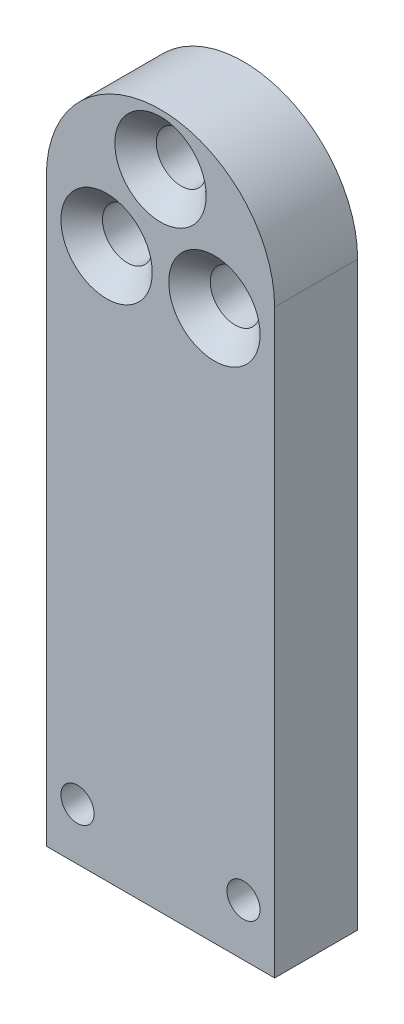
SolidWorks part; units mm, degrees
ref_plane "Plano frontal" through (0, 0, 0) normal (0, 0, 1) x (1, 0, 0)
ref_plane "Plano superior" through (0, 0, 0) normal (0, 1, 0) x (1, 0, 0)
ref_plane "Plano direito" through (0, 0, 0) normal (1, 0, 0) x (0, 0, -1)
sketch "Esboço1" plane through (0, 0, 0) normal (0, 0, 1) x (1, 0, 0)
  line L0 (-5.5, 0) -> (-5.5, -28)
  line L1 (5.5, 0) -> (5.5, -28)
  line L2 (5.5, -28) -> (-5.5, -28)
  arc A0 (5.5, 0) -> (-5.5, 0) centre (0, 0) ccw
  dimension "D1" = 11
  dimension "D2" = 28
extrude "Ressalto-extrusão1" add sketch "Esboço1" along normal blind 4
sketch "Esboço2" plane through (0, 0, 4) normal (0, 0, 1) x (1, 0, 0)
  circle A0 centre (0, 0) radius 3 construction
  point P3 (0, 3)
  point P11 (0, 0)
  dimension "D1" = 6
sketch "Esboço4" plane through (0, 0, 4) normal (0, 0, 1) x (1, 0, 0)
  line L0 (0, -28) -> (0, -25.5) construction
  line L1 (-5.5, -28) -> (5.5, -28) construction
  line L2 (-4, -25.5) -> (4, -25.5) construction
  dimension "D1" = 2.5
  dimension "D2" = 8
hole_wizard "Furo roscado de M21" positions "3DSketch3" profile "Esboço5" tap size "M2" standard "ISO"
sketch3d "3DSketch3"
  point P0 (-4, -25.5, 4)
  point P6 (4, -25.5, 4)
  point P10 (0, 0, 0)
sketch "Esboço5" plane through (-4, -25.5, 4) normal (1, 0, 0) x (0, -1, 0)
  line L0 (0, 0) -> (0, 4)
  line L1 (0, 4) -> (0.8, 4)
  line L2 (0.8, 4) -> (0.8, 0)
  line L5 (0.8, 0) -> (0, 0)
  line L11 (0, -6.35) -> (0, 107.95) construction
  dimension "Thru Tap Drill Dia." = 1.6
  dimension "Thru Tap Drill Depth" = 4
hole_wizard "Escareado para parafuso com cabeça escareada chata de M21" positions "3DSketch4" profile "Esboço6" countersink size "M2" standard "ISO"
sketch3d "3DSketch4"
  point P0 (0, 3, 4)
sketch "Esboço6" plane through (0, 3, 4) normal (1, 0, 0) x (0, -1, 0)
  line L0 (0, 0) -> (0, 4)
  line L1 (0, 4) -> (1.2, 4)
  line L2 (1.2, 4) -> (1.2, 1)
  line L3 (1.2, 1) -> (2.2, 0)
  line L5 (2.2, 0) -> (0, 0)
  line L6 (-1.2, 1) -> (-2.2, 0) construction
  line L11 (0, -6.35) -> (0, 107.95) construction
  dimension "Thru Hole Dia." = 2.4
  dimension "Thru Hole Depth" = 4
  dimension "Near C'Sink Dia." = 4.4
  dimension "Near C'Sink Angle" = 90
pattern_circular "PadrãoCircular1" count 3 over 360 about axis through (0, 0, 0) along (0, 0, 1) of "Escareado para parafuso com cabeça escareada chata de M21"
